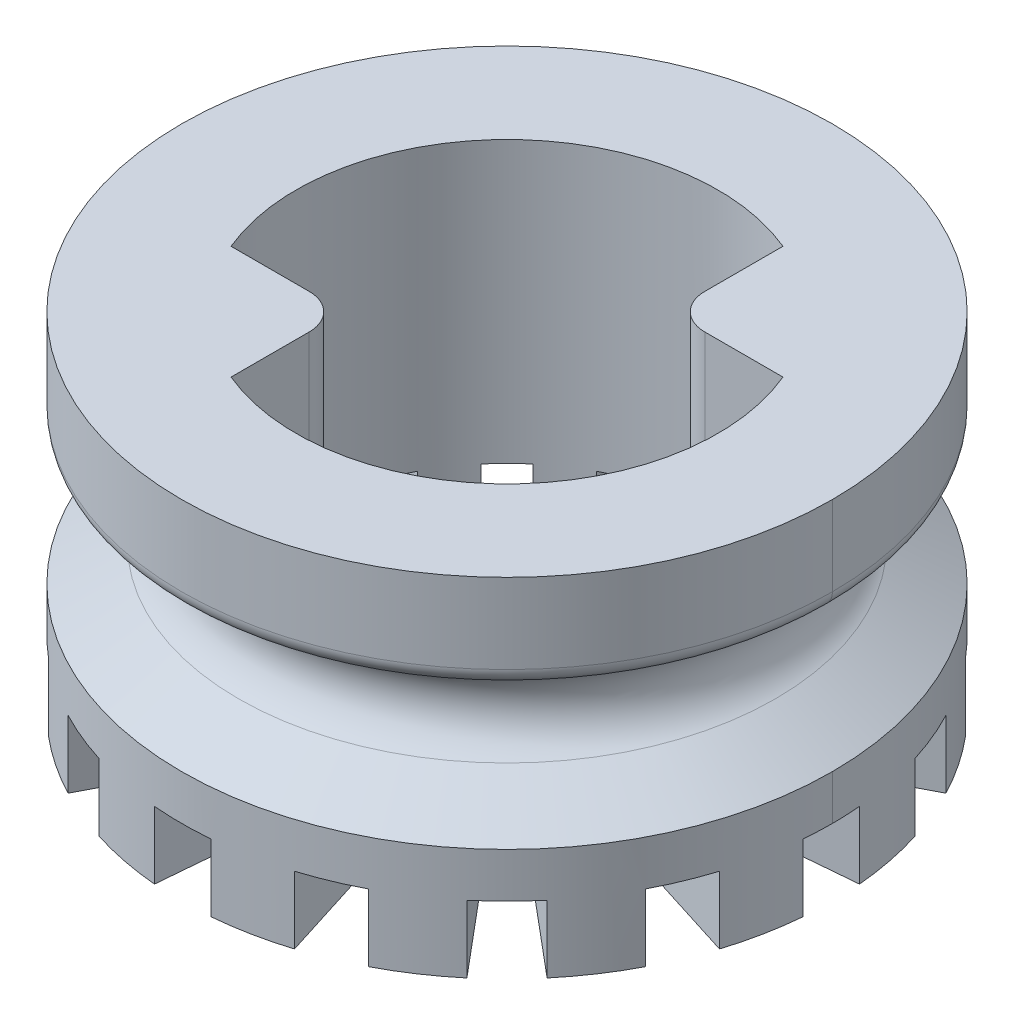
SolidWorks part; units mm, degrees
ref_plane "Front" through (0, 0, 0) normal (0, 0, 1) x (1, 0, 0)
ref_plane "Top" through (0, 0, 0) normal (0, 1, 0) x (1, 0, 0)
ref_plane "Right" through (0, 0, 0) normal (1, 0, 0) x (0, 0, -1)
sketch "Sketch1" plane through (0, 0, 0) normal (0, 1, 0) x (1, 0, 0)
  circle A0 centre (0, 0) radius 3.683
  dimension "D1" = 7.366
extrude "Base-Extrude" add sketch "Sketch1" along normal blind 3.937
sketch "Sketch2" plane through (0, 3.937, 0) normal (0, 1, 0) x (-1, 0, 0)
  circle A0 centre (0, 0) radius 2.3876
  dimension "D1" = 4.7752
extrude "Cut-Extrude1" cut sketch "Sketch2" against normal through all
sketch "Sketch4" plane through (0, 0, 0) normal (0, 0, 1) x (1, 0, 0)
  line L0 (-0.8167, 2.0955) -> (6.9225, 2.0955) construction
  line L1 (3.683, 2.921) -> (3.0384, 2.5298)
  line L2 (3.683, 0) -> (3.683, 3.937) construction
  line L3 (-3.683, 3.937) -> (3.683, 3.937) construction
  line L4 (3.683, 1.27) -> (3.0384, 1.6612)
  line L5 (0, 0) -> (0, 4.7179) construction
  line L6 (3.683, 2.921) -> (3.683, 1.27)
  arc A0 (3.0384, 2.5298) -> (3.0384, 1.6612) centre (3.302, 2.0955) ccw
  dimension "D4" = 0.508
  dimension "D1" = 1.016
  dimension "D2" = 1.651
  dimension "D3" = 5.588
revolve "Cut-Revolve1" cut sketch "Sketch4" angle 360 about L5
sketch "Sketch5" plane through (16.4943, 0, 2.5829) normal (0, -1, 0) x (1, 0, 0)
  line L0 (-16.4943, -2.5829) -> (-23.5814, -2.5829) construction
  line L1 (-16.4943, -2.5829) -> (-27.4899, -1.6209) construction
  line L2 (-18.8728, -2.3748) -> (-20.1633, -2.2619)
  line L3 (-18.8728, -2.791) -> (-20.1633, -2.9039)
  circle A0 centre (-16.4943, -2.5829) radius 2.3876 construction
  arc A1 (-18.8728, -2.3748) -> (-18.8728, -2.791) centre (-16.4943, -2.5829) ccw
  arc A2 (-20.1773, -2.5829) -> (-12.8113, -2.5829) centre (-16.4943, -2.5829) ccw construction
  arc A3 (-20.1633, -2.2619) -> (-20.1633, -2.9039) centre (-16.4943, -2.5829) ccw
  dimension "D1" = 10
extrude "Cut-Extrude2" cut sketch "Sketch5" against normal blind 0.762
pattern_circular "CirPattern1" count 16 every 22.5 about axis through (0, 0, 0) along (0, 1, 0) of "Cut-Extrude2"
sketch "Sketch6" plane through (0, 3.937, 0) normal (0, 1, 0) x (-1, 0, 0)
  line L0 (0, 0) -> (-4.1536, 0) construction
  line L1 (0, 0) -> (0, -5.1565) construction
  line L2 (-0.9208, -2.2029) -> (-0.9207, -0.9208)
  line L3 (-0.9207, -0.9208) -> (-2.2029, -0.9208)
  line L4 (0, 0) -> (-3.0791, 3.0791) construction
  line L5 (2.2029, 0.9207) -> (0.9208, 0.9207)
  line L6 (0.9208, 0.9207) -> (0.9208, 2.2029)
  circle A0 centre (0, 0) radius 2.3876 construction
  arc A1 (-2.2029, -0.9208) -> (-0.9208, -2.2029) centre (0, 0) ccw
  arc A2 (2.2029, 0.9207) -> (0.9208, 2.2029) centre (0, 0) ccw
  dimension "D1" = 0.9207
  dimension "D2" = 45
extrude "Boss-Extrude1" add sketch "Sketch6" against normal up to surface (3.175 mm away)
fillet "Fillet1" radius 0.3969 2 edges at (-0.9208, 2.3495, 0.9207) (0.9207, 2.3495, -0.9208)
fillet "Fillet2" radius 0.1984 2 edges at (0, 2.921, 3.683) (0, 2.921, -3.683)
